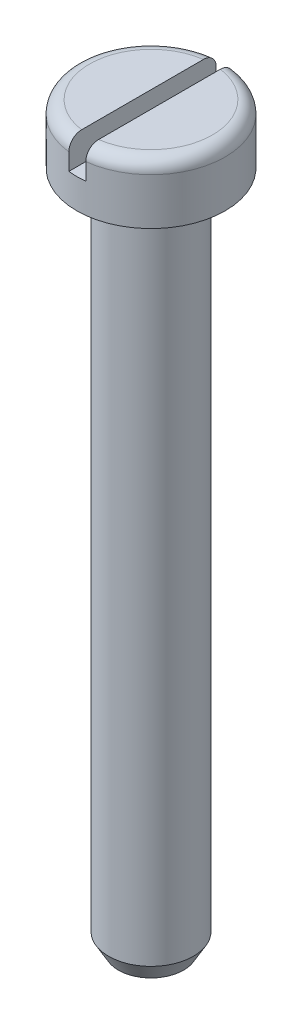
SolidWorks part; units mm, degrees
ref_plane "Plan de face" through (0, 0, 0) normal (0, 0, 1) x (1, 0, 0)
ref_plane "Plan de dessus" through (0, 0, 0) normal (0, 1, 0) x (1, 0, 0)
ref_plane "Plan de droite" through (0, 0, 0) normal (1, 0, 0) x (0, 0, -1)
sketch "Esquisse2" plane through (0, 0, 0) normal (0, 1, 0) x (1, 0, 0)
  circle A0 centre (0, 0) radius 1.75
  dimension "D1" = 3.5
extrude "Boss.-Extru.1" add sketch "Esquisse2" along normal blind 1.4
sketch "Esquisse3" plane through (0, 1.4, 0) normal (0, 1, 0) x (1, 0, 0)
  line L0 (0, 1.75) -> (0, -1.75) construction
  line L2 (-0.2, -2) -> (0.2, -2)
  line L3 (-0.2, -2) -> (-0.2, 2)
  line L4 (-0.2, 2) -> (0.2, 2)
  line L5 (0.2, -2) -> (0.2, 2)
  line L6 (-0.2, -2) -> (0.2, 2) construction
  line L7 (-0.2, 2) -> (0.2, -2) construction
  circle A0 centre (0, 0) radius 1.75 construction
  point P5 (0, 0)
  dimension "D1" = 0.4
  dimension "D2" = 4
extrude "Enlèv. mat.-Extru.1" cut sketch "Esquisse3" against normal blind 0.7
sketch "Esquisse4" plane through (0, 0, 0) normal (0, -1, 0) x (1, 0, 0)
  circle A0 centre (0, 0) radius 1
  dimension "D1" = 2
extrude "Boss.-Extru.2" add sketch "Esquisse4" along normal blind 16
chamfer "Chanfrein1" distance 0.4 angle 30 1 edges at (0, -16, -1)
fillet "Congé1" radius 0.3 2 edges at (1.75, 1.4, 0) (-1.75, 1.4, 0)
